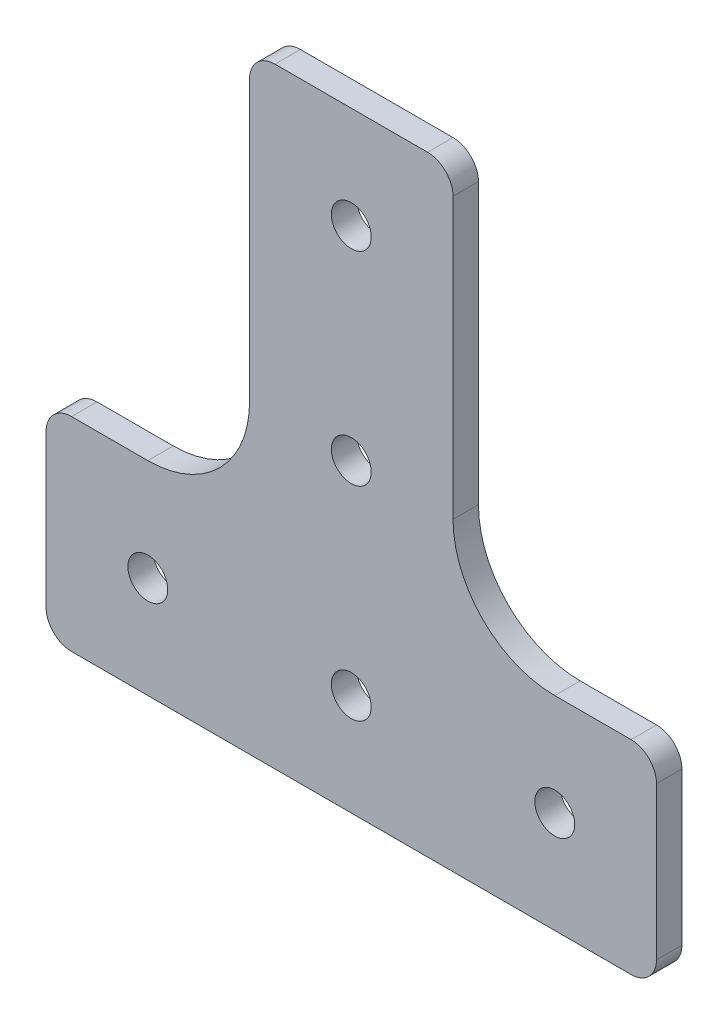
SolidWorks part; units mm, degrees
ref_plane "Front Plane" through (0, 0, 0) normal (0, 0, 1) x (1, 0, 0)
ref_plane "Top Plane" through (0, 0, 0) normal (0, 1, 0) x (1, 0, 0)
ref_plane "Right Plane" through (0, 0, 0) normal (1, 0, 0) x (0, 0, -1)
sketch "Sketch1" plane through (0, 0, 0) normal (0, 0, 1) x (1, 0, 0)
  line L0 (-38.1, 0) -> (38.1, 0)
  line L1 (-38.1, 0) -> (-38.1, 25.4)
  line L2 (-38.1, 25.4) -> (-12.7, 25.4)
  line L3 (-12.7, 25.4) -> (-12.7, 76.2)
  line L4 (-12.7, 76.2) -> (12.7, 76.2)
  line L5 (12.7, 76.2) -> (12.7, 25.4)
  line L6 (12.7, 25.4) -> (38.1, 25.4)
  line L7 (38.1, 25.4) -> (38.1, 0)
  point P2 (0, 0)
  point P3 (0, 76.2)
  dimension "D1" = 25.4
  dimension "D2" = 25.4
  dimension "D3" = 76.2
  dimension "D4" = 76.2
extrude "Boss-Extrude1" add sketch "Sketch1" along normal blind 3.175
fillet "Fillet1" radius 3.175 6 edges at (-38.1, 0, 1.5875) (38.1, 0, 1.5875) (38.1, 25.4, 1.5875) (12.7, 76.2, 1.5875) (-12.7, 76.2, 1.5875) (-38.1, 25.4, 1.5875)
fillet "Fillet2" radius 12.7 2 edges at (12.7, 25.4, 1.5875) (-12.7, 25.4, 1.5875)
sketch "Sketch2" plane through (0, 0, 3.175) normal (0, 0, 1) x (1, 0, 0)
  line L0 (-34.925, 0) -> (34.925, 0) construction
  line L1 (-25.4, 25.4) -> (-34.925, 25.4) construction
  circle A0 centre (0, 12.7) radius 2.4892
  circle A1 centre (25.4, 12.7) radius 2.4892
  circle A2 centre (-25.4, 12.7) radius 2.4892
  circle A3 centre (0, 38.1) radius 2.4892
  circle A4 centre (0, 63.5) radius 2.4892
  dimension "D4" = 4.9784
  dimension "D1" = 12.7
  dimension "D2" = 25.4
  dimension "D3" = 25.4
  dimension "D5" = 12.7
  dimension "D6" = 25.4
extrude "Cut-Extrude1" cut sketch "Sketch2" against normal through all
